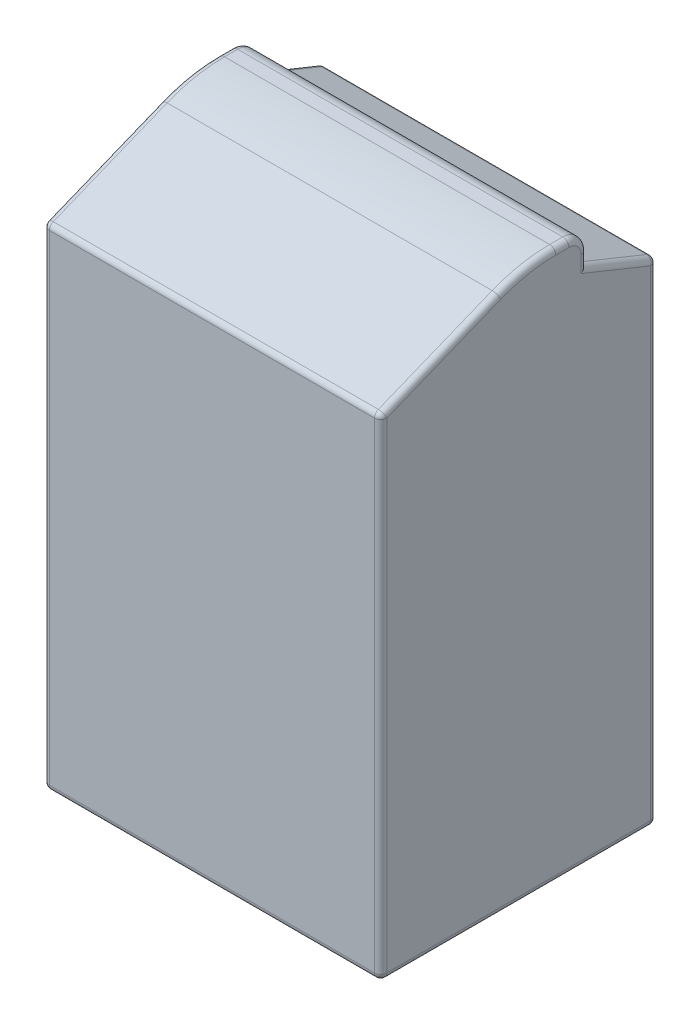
SolidWorks part; units mm, degrees
ref_plane "Front Plane" through (0, 0, 0) normal (0, 0, 1) x (1, 0, 0)
ref_plane "Top Plane" through (0, 0, 0) normal (0, 1, 0) x (1, 0, 0)
ref_plane "Right Plane" through (0, 0, 0) normal (1, 0, 0) x (0, 0, -1)
sketch "Sketch1" plane through (0, 0, 0) normal (1, 0, 0) x (0, 0, -1)
  line L0 (-22.5, 80) -> (-3.3179, 87.7501)
  line L2 (-22.5, 80) -> (-22.5, 0)
  line L3 (-22.5, 0) -> (22.5, 0)
  line L4 (22.5, 80) -> (22.5, 0)
  line L5 (6.0472, 89.5705) -> (8.1877, 89.5705)
  line L6 (11.1877, 86.5705) -> (11.1877, 84.5705)
  line L7 (11.1877, 84.5705) -> (22.5, 80)
  arc A0 (8.1877, 89.5705) -> (11.1877, 86.5705) centre (8.1877, 86.5705) cw
  arc A1 (-3.3179, 87.7501) -> (6.0472, 89.5705) centre (6.0472, 64.5705) cw
  point P12 (11.1877, 89.5705)
  point P14 (1.1877, 89.5705)
  dimension "D6" = 3
  dimension "D8" = 25
  dimension "D1" = 45
  dimension "D2" = 80
  dimension "D3" = 112
  dimension "D4" = 5
  dimension "D5" = 10
  dimension "D7" = 112
extrude "Boss-Extrude1" add sketch "Sketch1" along normal mid plane 55
fillet "Fillet1" radius 1 22 edges at (-27.5, 82.2852, -16.8439) (-27.5, 85.5705, -11.1877) (-27.5, 88.6918, -10.309) (-27.5, 89.5705, -7.1175) (-27.5, 83.875, 12.909) (27.5, 83.875, 12.909) (27.5, 89.5705, -7.1175) (27.5, 88.6918, -10.309) (27.5, 85.5705, -11.1877) (27.5, 82.2852, -16.8439) (27.5, 40, -22.5) (0, 80, -22.5) (-27.5, 40, -22.5) (0, 80, 22.5) (27.5, 40, 22.5) (-27.5, 40, 22.5) (0, 0, 22.5) (27.5, 0, 0) (0, 0, -22.5) (-27.5, 0, 0) (-27.5, 89.1111, -1.277) (27.5, 89.1111, -1.277)
